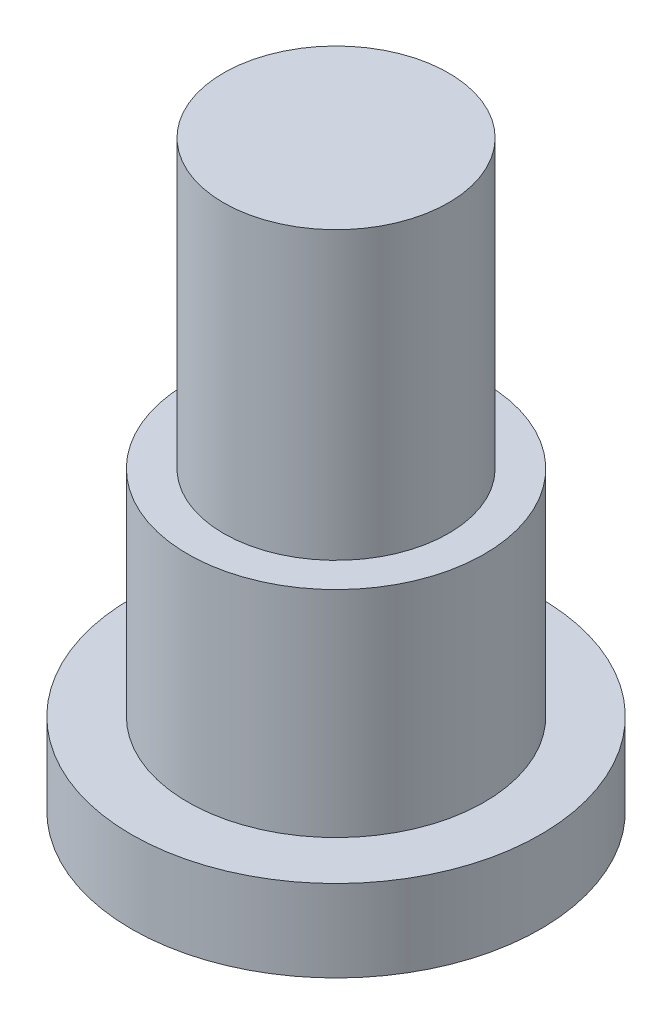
SolidWorks part; units mm, degrees
ref_plane "Plan de face" through (0, 0, 0) normal (0, 0, 1) x (1, 0, 0)
ref_plane "Plan de dessus" through (0, 0, 0) normal (0, 1, 0) x (1, 0, 0)
ref_plane "Plan de droite" through (0, 0, 0) normal (1, 0, 0) x (0, 0, -1)
sketch "Esquisse1" plane through (0, 0, 0) normal (0, 1, 0) x (1, 0, 0)
  circle A0 centre (0, 0) radius 10
extrude "Boss.-Extru.1" add sketch "Esquisse1" along normal blind 4
sketch "Esquisse3" plane through (0, 4, 0) normal (0, 1, 0) x (1, 0, 0)
  circle A0 centre (0, 0) radius 7.25
extrude "Boss.-Extru.2" add sketch "Esquisse3" along normal blind 10.5
sketch "Esquisse4" plane through (0, 14.5, 0) normal (0, 1, 0) x (1, 0, 0)
  circle A0 centre (0, 0) radius 5.5
extrude "Boss.-Extru.3" add sketch "Esquisse4" along normal blind 14
